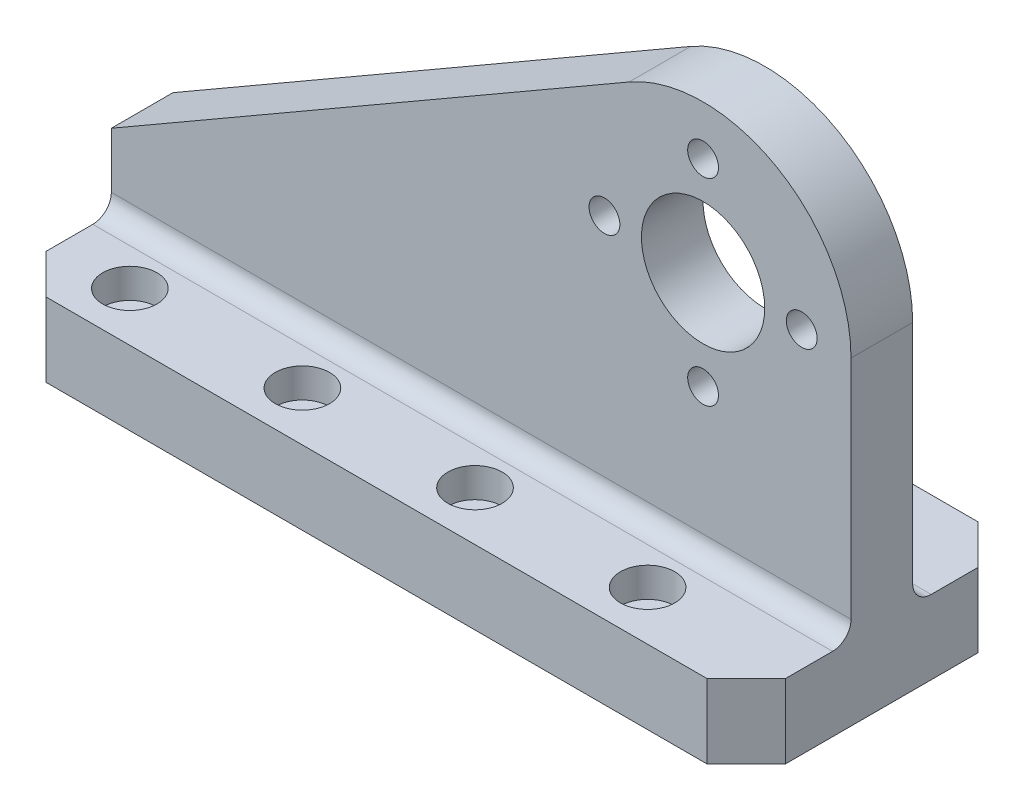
SolidWorks part; units mm, degrees
ref_plane "Front" through (0, 0, 0) normal (0, 0, 1) x (1, 0, 0)
ref_plane "Top" through (0, 0, 0) normal (0, 1, 0) x (1, 0, 0)
ref_plane "Right" through (0, 0, 0) normal (1, 0, 0) x (0, 0, -1)
sketch "Sketch1" plane through (0, 0, 0) normal (0, 0, 1) x (1, 0, 0)
  line L0 (0, 0) -> (60, 0)
  line L1 (60, 0) -> (60, 25.8564)
  line L2 (42, 36.2487) -> (0, 12)
  line L3 (0, 12) -> (0, 0)
  arc A0 (60, 25.8564) -> (42, 36.2487) centre (48, 25.8564) ccw
  circle A1 centre (48, 25.8564) radius 5
  dimension "D4" = 12
  dimension "D5" = 10
  dimension "D1" = 60
  dimension "D2" = 12
  dimension "D3" = 60
extrude "Boss-Extrude1" add sketch "Sketch1" along normal mid plane 5
sketch "Sketch2" plane through (0, 0, 0) normal (0, 1, 0) x (1, 0, 0)
  line L0 (60, -2.5) -> (60, 2.5) construction
  line L1 (0, 11) -> (60, 11)
  line L2 (0, 11) -> (0, -11)
  line L3 (0, -11) -> (60, -11)
  line L4 (60, 11) -> (60, -11)
  dimension "D1" = 22
extrude "Boss-Extrude2" add sketch "Sketch2" along normal blind 6
chamfer "Chamfer1" distance 3.2 angle 45 4 edges at (0, 3, -11) (60, 3, -11) (0, 3, 11) (60, 3, 11)
hole_wizard "CBORE for M2 Hex Socket Head Cap Screw1" positions "Sketch3" profile "Sketch4" counterbore size "M2" standard "ISO"
sketch "Sketch3" plane through (0, 6, 0) normal (0, 1, 0) x (1, 0, 0)
  line L0 (60, -7.8) -> (60, -2.5) construction
  line L1 (3.2, -11) -> (56.8, -11) construction
  point P0 (48, -7)
  dimension "D1" = 12
  dimension "D2" = 4
sketch "Sketch4" plane through (48, 6, 7) normal (1, 0, 0) x (0, 0, 1)
  line L0 (0, 0) -> (0, 6)
  line L1 (0, 6) -> (1.2, 6)
  line L3 (1.2, 6) -> (1.2, 2.4)
  line L4 (1.2, 2.4) -> (2.2, 2.4)
  line L5 (2.2, 2.4) -> (2.2, 0)
  line L7 (2.2, 0) -> (0, 0)
  line L11 (0, -6.35) -> (0, 107.95) construction
  dimension "Thru Hole Dia." = 2.4
  dimension "Thru Hole Depth" = 6
  dimension "C'Bore Dia." = 4.4
  dimension "C'Bore Depth" = 2.4
pattern_linear "LPattern1" count 4 spacing 14 along (-1, 0, 0) of "CBORE for M2 Hex Socket Head Cap Screw1"
mirror "Mirror1" about plane through (0, 0, 0) normal (0, 0, 1) of "LPattern1", "CBORE for M2 Hex Socket Head Cap Screw1"
hole_wizard "M3 Tapped Hole1" positions "Sketch6" profile "Sketch7" tap size "M3" standard "ISO"
sketch "Sketch6" plane through (0, 0, 2.5) normal (0, 0, 1) x (1, 0, 0)
  circle A0 centre (48, 25.8564) radius 8 construction
  point P0 (56, 25.8564)
  dimension "D1" = 16
sketch "Sketch7" plane through (56, 25.8564, 2.5) normal (1, 0, 0) x (0, -1, 0)
  line L0 (0, 0) -> (0, 13.5)
  line L1 (0, 13.5) -> (1.25, 13.5)
  line L2 (1.25, 13.5) -> (1.25, 0)
  line L5 (1.25, 0) -> (0, 0)
  line L11 (0, -6.35) -> (0, 107.95) construction
  dimension "Thru Tap Drill Dia." = 2.5
  dimension "Thru Tap Drill Depth" = 13.5
pattern_circular "CirPattern1" count 4 over 360 about axis through (48, 25.8564, 0) along (0, 0, 1) of "M3 Tapped Hole1"
fillet "Fillet1" radius 1.5 2 edges at (30, 6, -2.5) (30, 6, 2.5)
